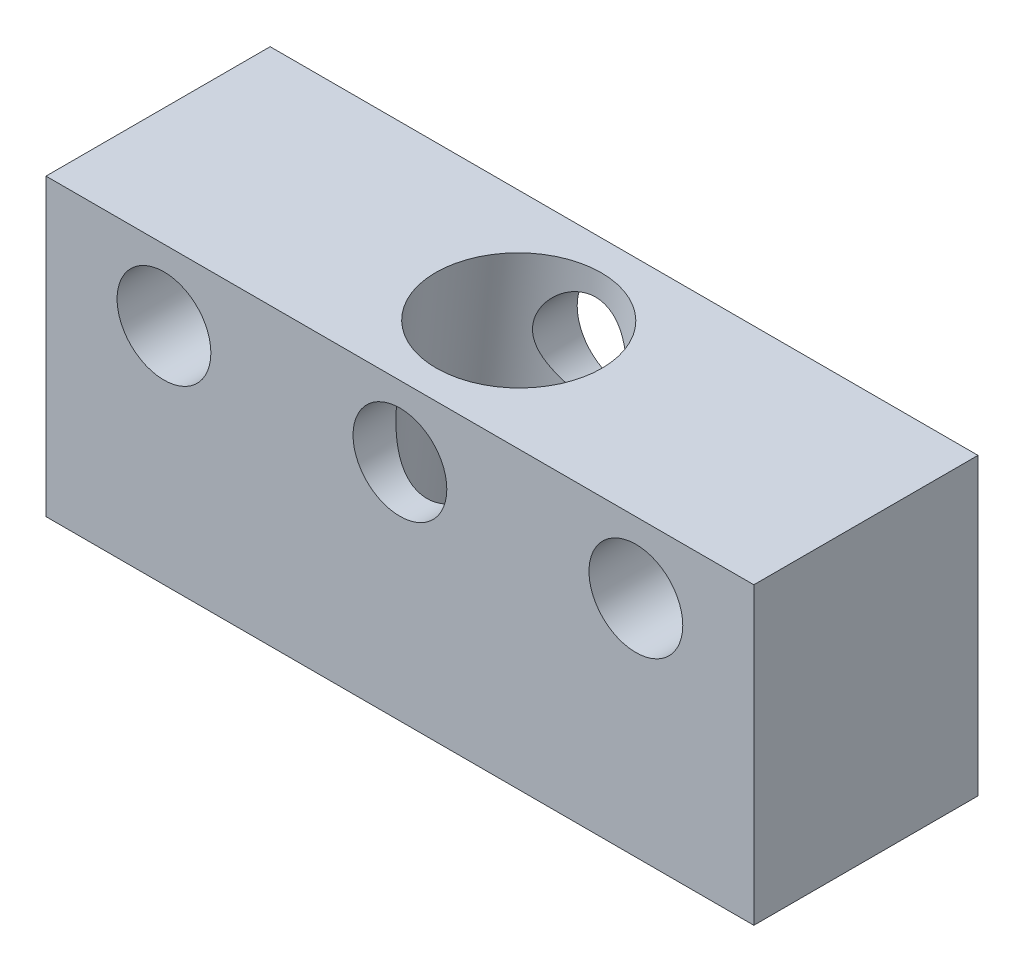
SolidWorks part; units mm, degrees
ref_plane "Plan1" through (0, 0, 0) normal (0, 0, 1) x (1, 0, 0)
ref_plane "Plan2" through (0, 0, 0) normal (0, 1, 0) x (1, 0, 0)
ref_plane "Plan3" through (0, 0, 0) normal (1, 0, 0) x (0, 0, -1)
sketch "Esquisse1" plane through (0, 0, 0) normal (0, 0, 1) x (1, 0, 0)
  line L0 (-30, 6) -> (30, 6)
  line L1 (-30, 6) -> (-30, -19)
  line L2 (30, -19) -> (-30, -19)
  line L3 (30, -19) -> (30, 6)
  circle A0 centre (-20, 0) radius 3.975
  circle A1 centre (0, 0) radius 3.975
  circle A2 centre (20, 0) radius 3.975
  dimension "D1" = 7.95
  dimension "D2" = 7.95
  dimension "D3" = 7.95
extrude "Base-Extrusion" add sketch "Esquisse1" along normal blind 19
ref_plane "Plan5" through (0, 0, 0) normal (0.9945, -0.1045, 0) x (0, 0, -1)
ref_plane "Plan7" through (-6.9617, 0.7317, 0) normal (0.9945, -0.1045, 0) x (0, 0, -1)
sketch "Esquisse2" plane through (0, 0, 0) normal (0.9945, -0.1045, 0) x (0, 0, -1)
  line L0 (-9.5593, 9.103) -> (-9.5593, -24) construction
  line L1 (-9.5593, 10.4478) -> (-2.5593, 10.4478)
  line L2 (-9.5593, 10.4478) -> (-9.5593, -24)
  line L3 (-2.5593, -24) -> (-9.5593, -24)
  line L4 (-2.5593, -24) -> (-2.5593, 10.4478)
  dimension "D1" = 7
revolve "Enlever de la matière-Révolution2" cut sketch "Esquisse2" angle 360 about L0
